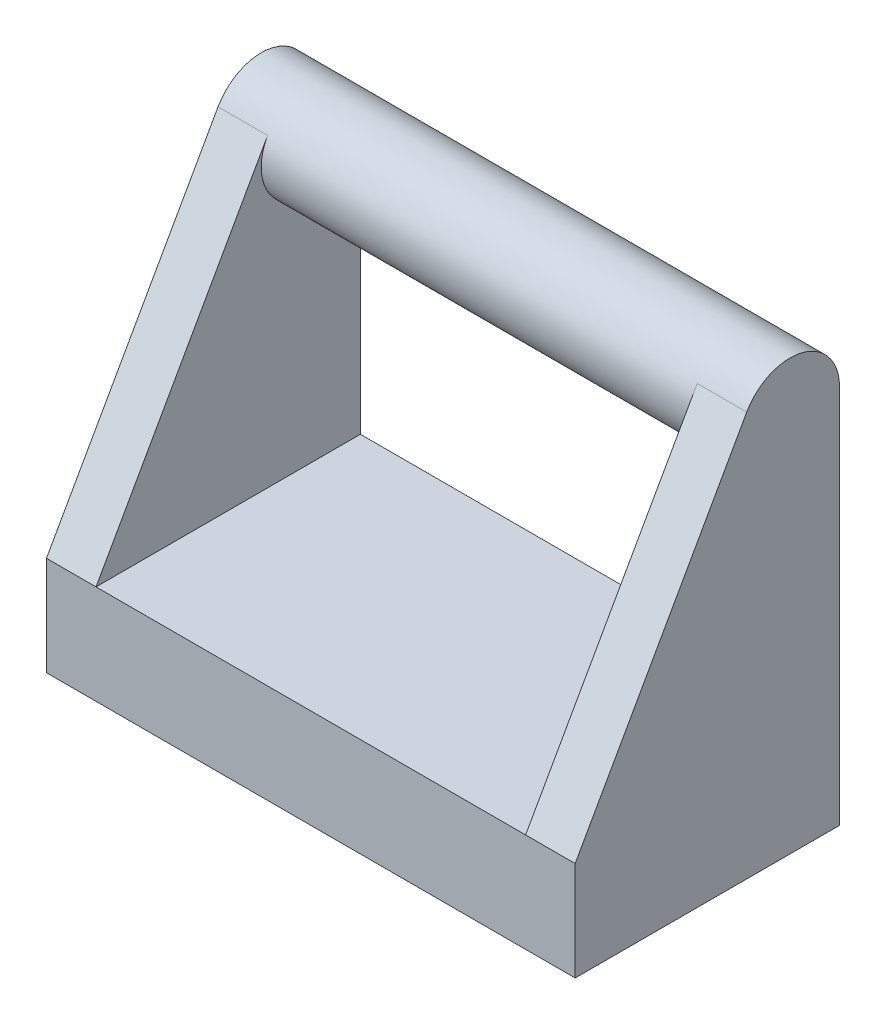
SolidWorks part; units mm, degrees
ref_plane "Face" through (0, 0, 0) normal (0, 0, 1) x (1, 0, 0)
ref_plane "Dessus" through (0, 0, 0) normal (0, 1, 0) x (1, 0, 0)
ref_plane "Droite" through (0, 0, 0) normal (1, 0, 0) x (0, 0, -1)
sketch "Esquisse2" plane through (0, 0, 0) normal (0, 1, 0) x (1, 0, 0)
  line L1 (0, 0) -> (16, 0)
  line L2 (0, 0) -> (0, -8)
  line L3 (0, -8) -> (16, -8)
  line L4 (16, 0) -> (16, -8)
  dimension "D1" = 8
  dimension "D2" = 16
extrude "Extrusion1" add sketch "Esquisse2" against normal blind 1
sketch "Esquisse3" plane through (0, -1, 0) normal (0, -1, 0) x (1, 0, 0)
  line L0 (0, 8) -> (16, 8) construction
  line L1 (16, 8) -> (16, 0) construction
  circle A0 centre (8, 4) radius 1.5
  circle A1 centre (8, 4) radius 1
  dimension "D1" = 3
  dimension "D2" = 2
  dimension "D3" = 4
  dimension "D4" = 8
extrude "Extrusion2" add sketch "Esquisse3" along normal blind 2
sketch "Esquisse4" plane through (0, -1, 0) normal (0, -1, 0) x (1, 0, 0)
  line L1 (16, 8) -> (0, 8)
  line L2 (16, 8) -> (16, 0)
  line L3 (16, 0) -> (0, 0)
  line L4 (0, 8) -> (0, 0)
  line L5 (1, 1) -> (15, 1)
  line L6 (1, 1) -> (1, 7)
  line L7 (1, 7) -> (15, 7)
  line L8 (15, 1) -> (15, 7)
  dimension "D1" = 1
  dimension "D2" = 1
  dimension "D3" = 1
  dimension "D4" = 1
extrude "Extrusion3" add sketch "Esquisse4" along normal blind 2
sketch "Esquisse7" plane through (16, 0, 0) normal (1, 0, 0) x (0, 0, -1)
  line L1 (0, -3) -> (0, 0) construction
  line L2 (-8, 0) -> (0, 0) construction
  line L3 (0, 0) -> (0, 8.5)
  line L4 (-8, 0) -> (-2.8075, 9.2351)
  line L5 (-8, 0) -> (0, 0)
  arc A0 (0, 8.5) -> (-2.8075, 9.2351) centre (-1.5, 8.5) ccw
  dimension "D1" = 3
  dimension "D2" = 1.5
  dimension "D3" = 8.5
extrude "Extrusion7" add sketch "Esquisse7" against normal blind 1.5
sketch "Esquisse8" plane through (16, 0, 0) normal (1, 0, 0) x (0, 0, -1)
  circle A0 centre (-1.5, 8.5) radius 1.5
  arc A3 (0, 8.5) -> (-2.8075, 9.2351) centre (-1.5, 8.5) ccw construction
  dimension "D1" = 3
extrude "Extrusion8" add sketch "Esquisse8" against normal up to vertex (16 mm away)
pattern_circular "Répétition circulaire1" [suppressed] count 2 every 180
pattern_linear "Répétition linéaire1" count 2 spacing 14.5 along (-1, 0, 0) of "Extrusion7"
